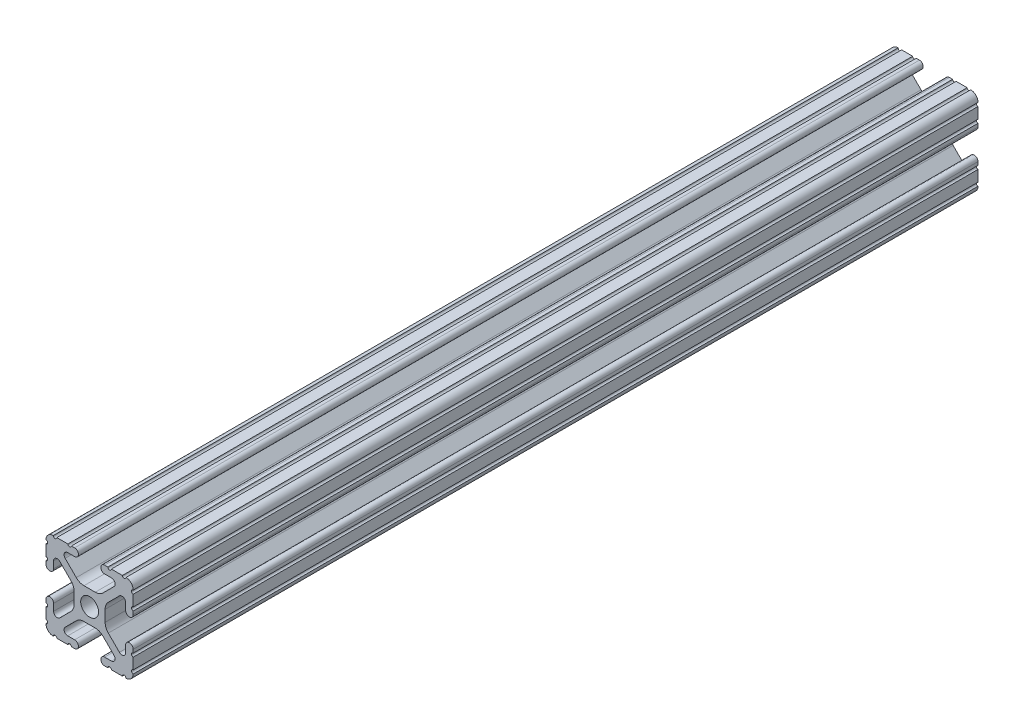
SolidWorks part; units mm, degrees
ref_plane "Front Plane" through (0, 0, 0) normal (0, 0, 1) x (1, 0, 0)
ref_plane "Top Plane" through (0, 0, 0) normal (0, 1, 0) x (1, 0, 0)
ref_plane "Right Plane" through (0, 0, 0) normal (1, 0, 0) x (0, 0, -1)
sketch "Sketch1" plane through (0, 0, 0) normal (0, 0, 1) x (1, 0, 0)
  line L0 (10.5918, 12.7) -> (10.5664, 12.7)
  line L1 (9.5504, 12.7) -> (6.3246, 12.7)
  line L2 (5.3086, 12.7) -> (4.3561, 12.7)
  line L3 (4.3561, 10.4902) -> (6.3701, 10.4902)
  line L4 (7.1192, 8.6817) -> (3.8846, 5.4471)
  line L5 (1.6396, 4.5172) -> (-1.6396, 4.5172)
  line L6 (-3.8846, 5.4471) -> (-7.1192, 8.6817)
  line L7 (-6.3701, 10.4902) -> (-4.3561, 10.4902)
  line L8 (-4.3561, 12.7) -> (-5.3086, 12.7)
  line L9 (-6.3246, 12.7) -> (-9.5504, 12.7)
  line L10 (-10.5664, 12.7) -> (-10.5918, 12.7)
  line L11 (-12.7, 10.5918) -> (-12.7, 10.5664)
  line L12 (-12.7, 9.5504) -> (-12.7, 6.3246)
  line L13 (-12.7, 5.3086) -> (-12.7, 4.3561)
  line L14 (-10.4902, 4.3561) -> (-10.4902, 6.3701)
  line L15 (-8.6817, 7.1192) -> (-5.4471, 3.8846)
  line L16 (-4.5172, 1.6396) -> (-4.5172, -1.6396)
  line L17 (-5.4471, -3.8846) -> (-8.6817, -7.1192)
  line L18 (-10.4902, -6.3701) -> (-10.4902, -4.3561)
  line L19 (-12.7, -4.3561) -> (-12.7, -5.3086)
  line L20 (-12.7, -6.3246) -> (-12.7, -9.5504)
  line L21 (-12.7, -10.5664) -> (-12.7, -10.5918)
  line L22 (-10.5918, -12.7) -> (-10.5664, -12.7)
  line L23 (-9.5504, -12.7) -> (-6.3246, -12.7)
  line L24 (-5.3086, -12.7) -> (-4.3561, -12.7)
  line L25 (-4.3561, -10.4902) -> (-6.3701, -10.4902)
  line L26 (-7.1192, -8.6817) -> (-3.8846, -5.4471)
  line L27 (-1.6396, -4.5172) -> (1.6396, -4.5172)
  line L28 (3.8846, -5.4471) -> (7.1192, -8.6817)
  line L29 (6.3701, -10.4902) -> (4.3561, -10.4902)
  line L30 (4.3561, -12.7) -> (5.3086, -12.7)
  line L31 (6.3246, -12.7) -> (9.5504, -12.7)
  line L32 (10.5664, -12.7) -> (10.5918, -12.7)
  line L33 (12.7, -10.5918) -> (12.7, -10.5664)
  line L34 (12.7, -9.5504) -> (12.7, -6.3246)
  line L35 (12.7, -5.3086) -> (12.7, -4.3561)
  line L36 (10.4902, -4.3561) -> (10.4902, -6.3701)
  line L37 (8.6817, -7.1192) -> (5.4471, -3.8846)
  line L38 (4.5172, -1.6396) -> (4.5172, 1.6396)
  line L39 (5.4471, 3.8846) -> (8.6817, 7.1192)
  line L40 (10.4902, 6.3701) -> (10.4902, 4.3561)
  line L41 (12.7, 4.3561) -> (12.7, 5.3086)
  line L42 (12.7, 6.3246) -> (12.7, 9.5504)
  line L43 (12.7, 10.5664) -> (12.7, 10.5918)
  circle A0 centre (0, 0) radius 2.6035
  arc A1 (12.7, 10.5918) -> (10.5918, 12.7) centre (10.5918, 10.5918) ccw
  arc A2 (9.5504, 12.7) -> (10.5664, 12.7) centre (10.0584, 12.7) ccw
  arc A3 (5.3086, 12.7) -> (6.3246, 12.7) centre (5.8166, 12.7) ccw
  arc A4 (4.3561, 12.7) -> (4.3561, 10.4902) centre (4.3561, 11.5951) ccw
  arc A5 (7.1192, 8.6817) -> (6.3701, 10.4902) centre (6.3701, 9.4308) ccw
  arc A6 (1.6396, 4.5172) -> (3.8846, 5.4471) centre (1.6396, 7.6922) ccw
  arc A7 (-3.8846, 5.4471) -> (-1.6396, 4.5172) centre (-1.6396, 7.6922) ccw
  arc A8 (-6.3701, 10.4902) -> (-7.1192, 8.6817) centre (-6.3701, 9.4308) ccw
  arc A9 (-4.3561, 10.4902) -> (-4.3561, 12.7) centre (-4.3561, 11.5951) ccw
  arc A10 (-6.3246, 12.7) -> (-5.3086, 12.7) centre (-5.8166, 12.7) ccw
  arc A11 (-10.5664, 12.7) -> (-9.5504, 12.7) centre (-10.0584, 12.7) ccw
  arc A12 (-10.5918, 12.7) -> (-12.7, 10.5918) centre (-10.5918, 10.5918) ccw
  arc A13 (-12.7, 9.5504) -> (-12.7, 10.5664) centre (-12.7, 10.0584) ccw
  arc A14 (-12.7, 5.3086) -> (-12.7, 6.3246) centre (-12.7, 5.8166) ccw
  arc A15 (-12.7, 4.3561) -> (-10.4902, 4.3561) centre (-11.5951, 4.3561) ccw
  arc A16 (-8.6817, 7.1192) -> (-10.4902, 6.3701) centre (-9.4308, 6.3701) ccw
  arc A17 (-4.5172, 1.6396) -> (-5.4471, 3.8846) centre (-7.6922, 1.6396) ccw
  arc A18 (-5.4471, -3.8846) -> (-4.5172, -1.6396) centre (-7.6922, -1.6396) ccw
  arc A19 (-10.4902, -6.3701) -> (-8.6817, -7.1192) centre (-9.4308, -6.3701) ccw
  arc A20 (-10.4902, -4.3561) -> (-12.7, -4.3561) centre (-11.5951, -4.3561) ccw
  arc A21 (-12.7, -6.3246) -> (-12.7, -5.3086) centre (-12.7, -5.8166) ccw
  arc A22 (-12.7, -10.5664) -> (-12.7, -9.5504) centre (-12.7, -10.0584) ccw
  arc A23 (-12.7, -10.5918) -> (-10.5918, -12.7) centre (-10.5918, -10.5918) ccw
  arc A24 (-9.5504, -12.7) -> (-10.5664, -12.7) centre (-10.0584, -12.7) ccw
  arc A25 (-5.3086, -12.7) -> (-6.3246, -12.7) centre (-5.8166, -12.7) ccw
  arc A26 (-4.3561, -12.7) -> (-4.3561, -10.4902) centre (-4.3561, -11.5951) ccw
  arc A27 (-7.1192, -8.6817) -> (-6.3701, -10.4902) centre (-6.3701, -9.4308) ccw
  arc A28 (-1.6396, -4.5172) -> (-3.8846, -5.4471) centre (-1.6396, -7.6922) ccw
  arc A29 (3.8846, -5.4471) -> (1.6396, -4.5172) centre (1.6396, -7.6922) ccw
  arc A30 (6.3701, -10.4902) -> (7.1192, -8.6817) centre (6.3701, -9.4308) ccw
  arc A31 (4.3561, -10.4902) -> (4.3561, -12.7) centre (4.3561, -11.5951) ccw
  arc A32 (6.3246, -12.7) -> (5.3086, -12.7) centre (5.8166, -12.7) ccw
  arc A33 (10.5664, -12.7) -> (9.5504, -12.7) centre (10.0584, -12.7) ccw
  arc A34 (10.5918, -12.7) -> (12.7, -10.5918) centre (10.5918, -10.5918) ccw
  arc A35 (12.7, -9.5504) -> (12.7, -10.5664) centre (12.7, -10.0584) ccw
  arc A36 (12.7, -5.3086) -> (12.7, -6.3246) centre (12.7, -5.8166) ccw
  arc A37 (12.7, -4.3561) -> (10.4902, -4.3561) centre (11.5951, -4.3561) ccw
  arc A38 (8.6817, -7.1192) -> (10.4902, -6.3701) centre (9.4308, -6.3701) ccw
  arc A39 (4.5172, -1.6396) -> (5.4471, -3.8846) centre (7.6922, -1.6396) ccw
  arc A40 (5.4471, 3.8846) -> (4.5172, 1.6396) centre (7.6922, 1.6396) ccw
  arc A41 (10.4902, 6.3701) -> (8.6817, 7.1192) centre (9.4308, 6.3701) ccw
  arc A42 (10.4902, 4.3561) -> (12.7, 4.3561) centre (11.5951, 4.3561) ccw
  arc A43 (12.7, 6.3246) -> (12.7, 5.3086) centre (12.7, 5.8166) ccw
  arc A44 (12.7, 10.5664) -> (12.7, 9.5504) centre (12.7, 10.0584) ccw
extrude "Extrude1" add sketch "Sketch1" against normal blind 246
